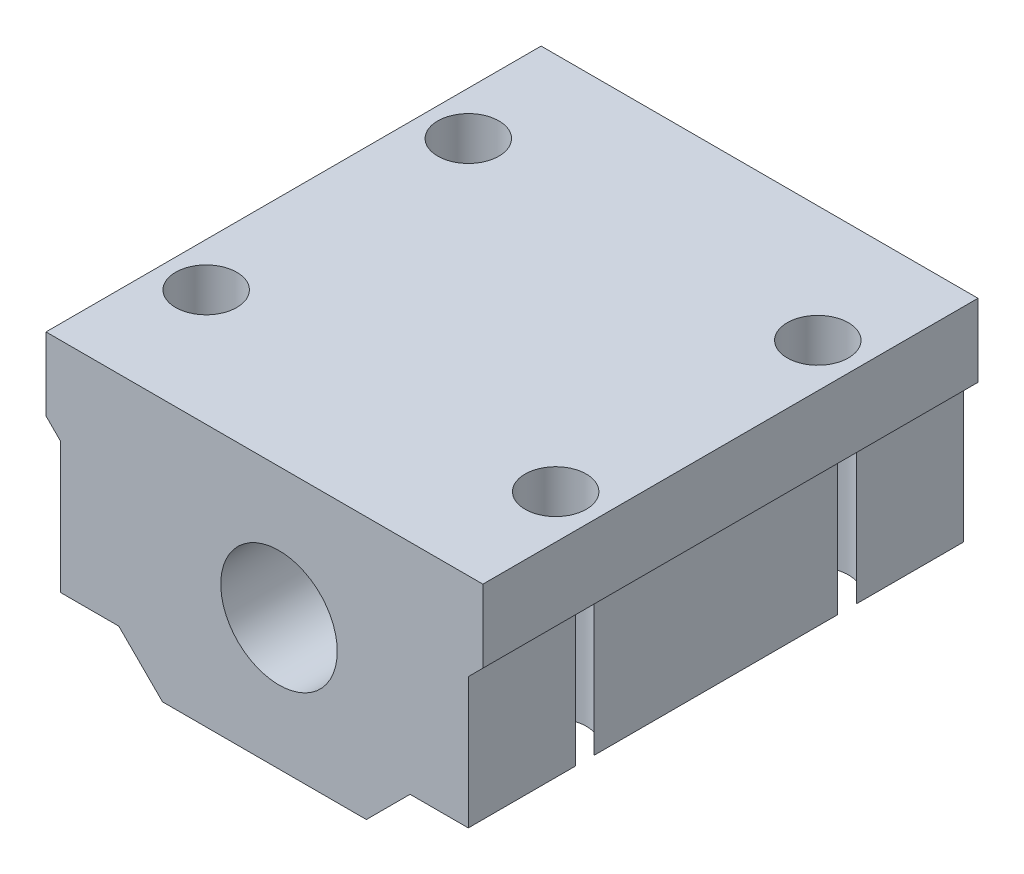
SolidWorks part; units mm, degrees
ref_plane "Спереди" through (0, 0, 0) normal (0, 0, 1) x (1, 0, 0)
ref_plane "Сверху" through (0, 0, 0) normal (0, 1, 0) x (1, 0, 0)
ref_plane "Справа" through (0, 0, 0) normal (1, 0, 0) x (0, 0, -1)
sketch "Эскиз1" plane through (0, 0, 0) normal (0, 0, 1) x (1, 0, 0)
  line L0 (-11, -6) -> (-8, -9)
  line L1 (-16, 9) -> (14, 9)
  line L3 (-8, -9) -> (6, -9)
  line L4 (14, 9) -> (14, 4)
  line L5 (-16, 9) -> (14, 9)
  line L6 (-16, 9) -> (-16, 4)
  line L7 (-15, -6) -> (13, -6)
  line L8 (14, 9) -> (14, 4)
  line L9 (9, -6) -> (6, -9)
  line L10 (-15, 3) -> (-16, 4)
  line L12 (13, 3) -> (14, 4)
  line L14 (-15, 3) -> (-15, -6)
  line L18 (13, 3) -> (13, -6)
  circle A0 centre (0, 0) radius 4
  point P9 (-16, 0)
  point P11 (-11, -6)
  point P12 (9, -6)
  dimension "D1" = 8
  dimension "D2" = 14
  dimension "D3" = 30
  dimension "D4" = 15
  dimension "D5" = 4
  dimension "D6" = 4
  dimension "D7" = 45
  dimension "D8" = 45
  dimension "D9" = 6
  dimension "D10" = 6
  dimension "D11" = 15
  dimension "D12" = 9
  dimension "D13" = 45
  dimension "D14" = 1
  dimension "D15" = 1
  dimension "D16" = 45
extrude "Бобышка-Вытянуть2" add sketch "Эскиз1" along normal blind 34 contours L18 L12 L4 L1 L6 L10 L14 L7 A0 | L9 L7 L0 L3
sketch "Эскиз2" plane through (0, 9, 0) normal (0, 1, 0) x (1, 0, 0)
  line L1 (-16, -34) -> (-16, 0) construction
  line L2 (-16, -34) -> (14, -34) construction
  circle A0 centre (-13, -8) radius 2.1
  circle A1 centre (-13, -26) radius 2.1
  circle A2 centre (11, -8) radius 2.1
  circle A3 centre (11, -26) radius 2.1
  point P0 (-13, -8)
  point P1 (11, -8)
  point P2 (-13, -26)
  point P3 (11, -26)
  point P8 (-16, -17)
  point P9 (-1, -34)
extrude "Вырез-Вытянуть1" cut sketch "Эскиз2" against normal through all
equation "\"D6@Эскиз2\"=\"D5@Эскиз2\"/2"
equation "\"D2@Эскиз2\"=\"D1@Эскиз2\"/2"
